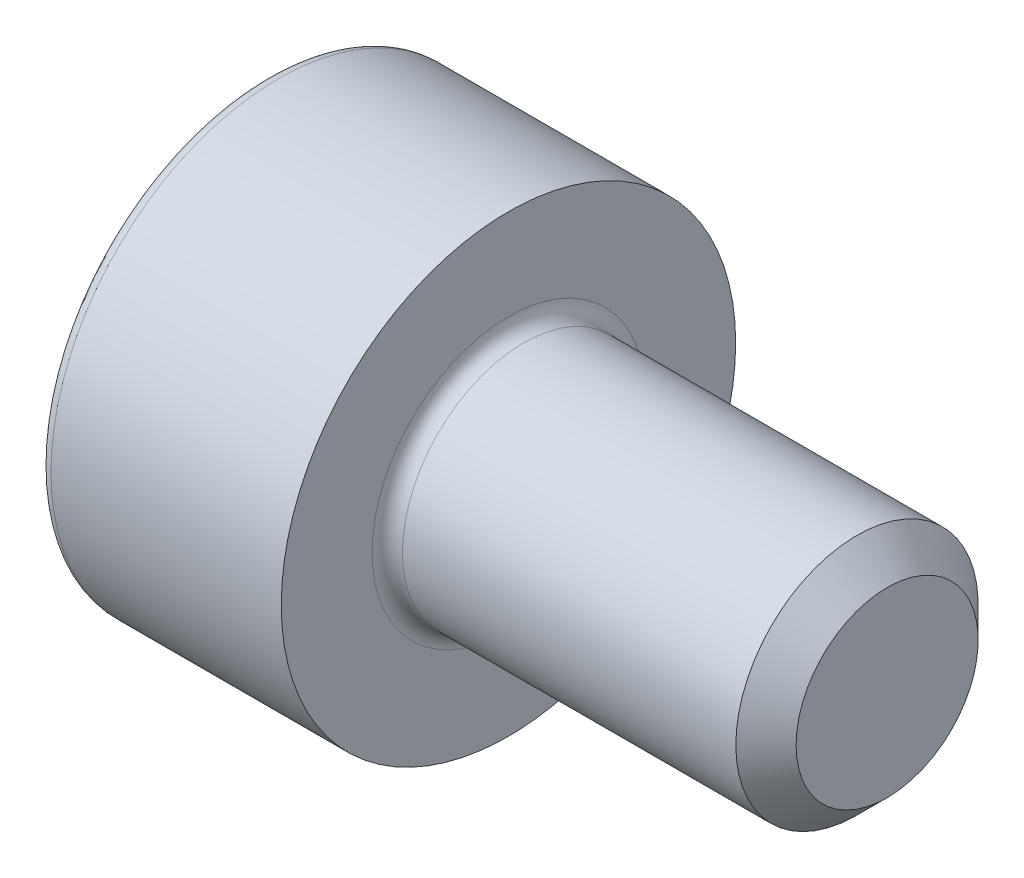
SolidWorks part; units mm, degrees
ref_plane "Front Plane" through (0, 0, 0) normal (0, 0, 1) x (1, 0, 0)
ref_plane "Top Plane" through (0, 0, 0) normal (0, 1, 0) x (1, 0, 0)
ref_plane "Right Plane" through (0, 0, 0) normal (1, 0, 0) x (0, 0, -1)
sketch "BodySke" plane through (0, 0, 0) normal (0, 0, 1) x (1, 0, 0)
  line L0 (0, 0) -> (5.8492, 0) construction
  line L1 (0, 0) -> (0, 1.5)
  line L2 (0, 1.5) -> (1.6, 1.5)
  line L3 (1.6, 1.5) -> (1.6, 0.8)
  line L4 (1.6, 0.8) -> (3.901, 0.8)
  line L5 (3.901, 0.8) -> (4.1, 0.601)
  line L6 (4.1, 0.601) -> (4.1, 0)
  line L7 (4.1, 0) -> (0, 0)
  line L8 (1.6, 0) -> (1.6, 0.601) construction
  line L9 (1.95, 1.5877) -> (1.95, 0.9267) construction
  dimension "Diameter" = 1.6
  dimension "Thread_minor" = 1.202
  dimension "Body_chamfer_angle" = 45
  dimension "Length" = 2.5
  dimension "Head_diameter" = 3
  dimension "Head_length" = 1.6
  dimension "Thread_length" = 2.5
  dimension "Advance" = 0.35
revolve "BaseBody" add sketch "BodySke" angle 360 about L0
fillet "Fillet1" radius 0.1 1 edges at (1.6, 0, 0.8)
fillet "Fillet2" radius 0.08 1 edges at (0, 0, 1.5)
sketch "HexSke" plane through (0, 0, 0) normal (1, 0, 0) x (0, 0, -1)
  line L1 (0, 0.866) -> (-0.75, 0.433)
  line L2 (-0.75, 0.433) -> (-0.75, -0.433)
  line L3 (-0.75, -0.433) -> (0, -0.866)
  line L4 (0, -0.866) -> (0.75, -0.433)
  line L5 (0.75, -0.433) -> (0.75, 0.433)
  line L6 (0.75, 0.433) -> (0, 0.866)
  circle A0 centre (0, 0) radius 0.75 construction
  dimension "Hex_size" = 1.5
extrude "Hex" cut sketch "HexSke" along normal blind 0.7
sketch "Hex-PreBroachSke" plane through (0, 0, 0) normal (0, 0, 1) x (1, 0, 0)
  line L0 (0, 0) -> (4.7325, 0) construction
  line L1 (0, 1.42) -> (0, -1.42) construction
  line L2 (0, 0) -> (0, 0.75)
  line L3 (0, 0.75) -> (0.7, 0.75)
  line L4 (0.7, 0.75) -> (1.133, 0)
  line L5 (1.133, 0) -> (0, 0)
  dimension "D1" = 1.5
  dimension "Hex_depth" = 0.7
  dimension "Angle" = 60
revolve "Hex-PreBroach" cut sketch "Hex-PreBroachSke" angle 360 about L0
sketch "ThdSchSke" plane through (0, 0, 0) normal (0, 0, 1) x (1, 0, 0)
  line L0 (0, 0) -> (4.4125, 0) construction
  line L1 (0, 1.42) -> (0, -1.42) construction
  line L2 (3.551, 1.0298) -> (3.551, 0.8)
  line L3 (3.551, 1.0298) -> (3.7808, 1.0298)
  line L4 (3.7808, 1.0298) -> (3.7808, 0.8)
  line L5 (3.7808, 0.8) -> (3.6659, 0.601)
  line L6 (3.6659, 0.601) -> (3.551, 0.8)
  dimension "D1" = 0.35
revolve "ThreadSchematic" [suppressed] cut sketch "ThdSchSke" angle 360 about L0
pattern_linear "ThdSchPat" [suppressed]
equation "\"Thread_length@ThreadCosmetic\" = \"Thread_length@BodySke\""
equation "\"Thread_minor@ThreadCosmetic\" = \"Thread_minor@BodySke\""
equation "\"Hex_depth@Hex-PreBroachSke\" = \"Hex_length@Hex\""
equation "\"D1@Hex-PreBroachSke\" = \"Hex_size@HexSke\""
equation "\"D1@ThdSchSke\" = \"Advance@BodySke\""
equation "\"Advance@ThdSchPat\" = \"Advance@BodySke\""
equation "\"Tooth_Num@ThdSchPat\" =  int( \"Thread_length@BodySke\" / \"Advance@BodySke\" )  - 1"
